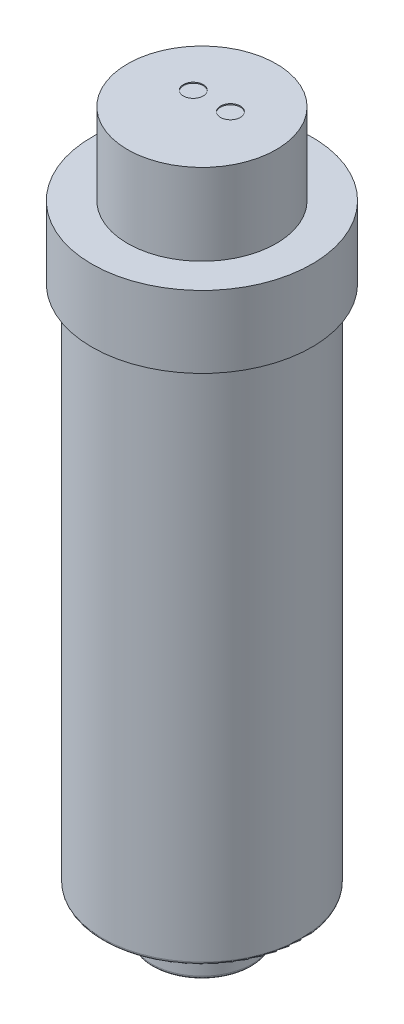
SolidWorks part; units mm, degrees
ref_plane "Front" through (0, 0, 0) normal (0, 0, 1) x (1, 0, 0)
ref_plane "Top" through (0, 0, 0) normal (0, 1, 0) x (1, 0, 0)
ref_plane "Right" through (0, 0, 0) normal (1, 0, 0) x (0, 0, -1)
sketch "Sketch1" plane through (0, 0, 0) normal (0, 1, 0) x (1, 0, 0)
  circle A0 centre (0, 0) radius 25.4254
  dimension "D1" = 50.8508
extrude "Extrude1" add sketch "Sketch1" along normal blind 133.35
sketch "Sketch2" plane through (0, 133.35, 0) normal (0, 1, 0) x (-1, 0, 0)
  circle A3 centre (0, 0) radius 28.194
  dimension "D1" = 56.388
extrude "Extrude2" add sketch "Sketch2" along normal blind 18.415
sketch "Sketch9" plane through (0, 151.765, 0) normal (0, 1, 0) x (1, 0, 0)
  circle A0 centre (0, 0) radius 19.05
  dimension "D1" = 38.1
extrude "Extrude6" add sketch "Sketch9" along normal blind 20.828
sketch "Sketch10" plane through (0, 172.593, 0) normal (0, 1, 0) x (1, 0, 0)
  line L0 (12.9352, 0) -> (-11.4062, 0) construction
  circle A0 centre (-4.7625, 2.54) radius 2.54
  circle A1 centre (4.7625, 2.54) radius 2.54
  dimension "D1" = 5.08
  dimension "D2" = 9.525
  dimension "D3" = 4.7625
extrude "Extrude7" cut sketch "Sketch10" against normal blind 0.254
sketch "Sketch7" plane through (0, 0, 0) normal (0, -1, 0) x (1, 0, 0)
  circle A0 centre (0, 0) radius 12.7635
  dimension "D1" = 25.527
extrude "Extrude4" add sketch "Sketch7" along normal blind 12.065
sketch "Sketch8" plane through (0, 0, 0) normal (0, 0, 1) x (1, 0, 0)
  line L1 (-12.7635, -12.065) -> (12.7635, -12.065) construction
  circle A0 centre (0, -5.715) radius 3.3401
  dimension "D2" = 6.6802
  dimension "D1" = 6.35
extrude "Extrude5" cut sketch "Sketch8" against normal through all and the other way through all
fillet "Fillet1" radius 0.7937 3 edges at (0, -12.065, -12.7635) (0, 0, 12.7635) (0, 0, 25.4254)
equation "\"Buoyancy\"=\"SW-Volume\"*(\"SW-Density\"-.037062)"
